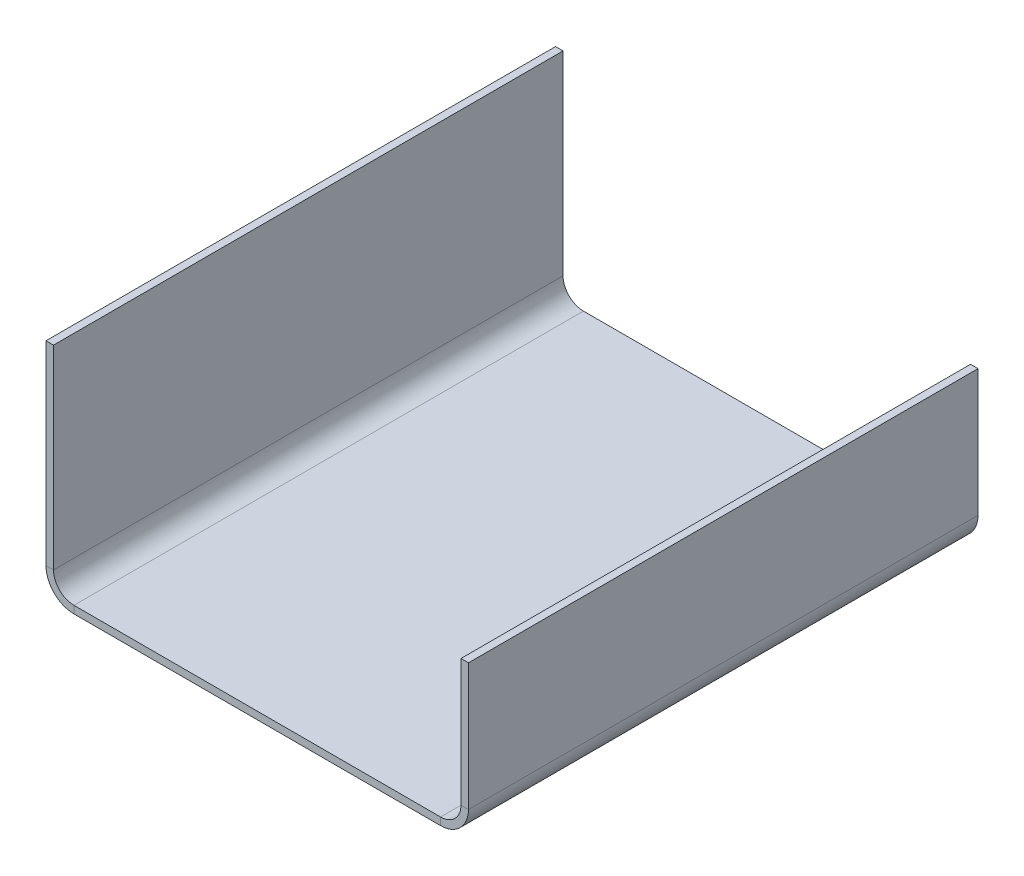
SolidWorks part; units mm, degrees
ref_plane "Front" through (0, 0, 0) normal (0, 0, 1) x (1, 0, 0)
ref_plane "Top" through (0, 0, 0) normal (0, 1, 0) x (1, 0, 0)
ref_plane "Right" through (0, 0, 0) normal (1, 0, 0) x (0, 0, -1)
sketch "Sketch1" plane through (0, 0, 0) normal (0, 1, 0) x (1, 0, 0)
  line L1 (0, 0) -> (75, 0)
  line L2 (0, 0) -> (0, 50)
  line L3 (0, 50) -> (75, 50)
  line L4 (75, 0) -> (75, 50)
  dimension "D1" = 75
  dimension "D2" = 50
sheet metal parameters "Sheet-Metal1" thickness 0.7366 parameters "D1"=2
base flange "Base-Flange1" sketch "Sketch1" thickness 0.7366 reverse thickness direction yes parameters "D1"=2
sketch "Sketch7" plane through (0, 0.7366, 0) normal (0, 1, 0) x (-1, 0, 0)
  line L0 (-60.6711, -50) -> (-60.6711, 0)
  line L1 (-75, -50) -> (0, -50) construction
  line L2 (0, 0) -> (-75, 0) construction
  line L3 (-20.9698, -50) -> (-20.9698, 0)
sketched bend "Sketched Bend11" parameters "D1"=2
bend "SketchBend13" bend radius 2 bend angle 90 parameters "D5"=1
bend "SketchBend14" bend radius 0 bend angle 90 parameters "D5"=2
flat pattern "Flat-Pattern1"
sketch "Bend-Lines1" plane through (0, 0, 0) normal (0, 1, 0) x (-1, 0, 0)
bend of the flat pattern "Flatten-<SketchBend13>1"
bend of the flat pattern "Flatten-<SketchBend14>1"
